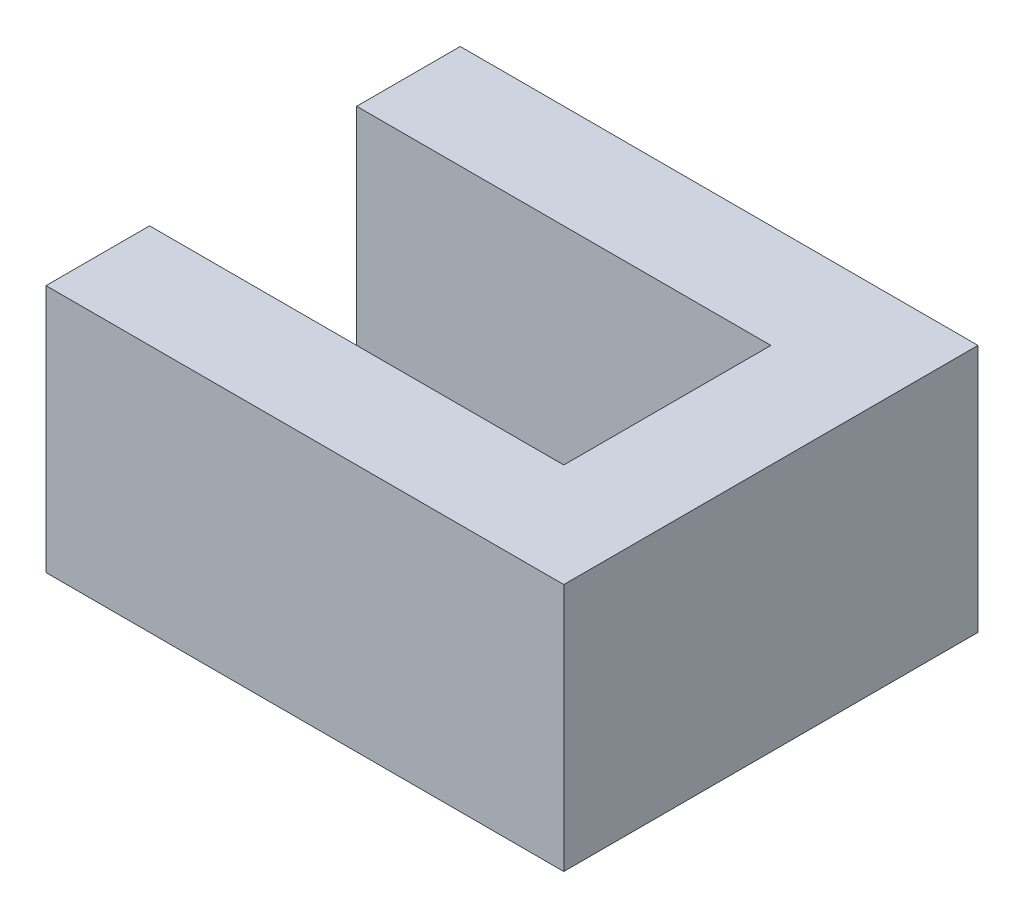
SolidWorks part; units mm, degrees
ref_plane "Plan de face" through (0, 0, 0) normal (0, 0, 1) x (1, 0, 0)
ref_plane "Plan de dessus" through (0, 0, 0) normal (0, 1, 0) x (1, 0, 0)
ref_plane "Plan de droite" through (0, 0, 0) normal (1, 0, 0) x (0, 0, -1)
sketch "Esquisse1" plane through (0, 0, 0) normal (0, 1, 0) x (1, 0, 0)
  line L0 (0, 10) -> (-40, 10)
  line L1 (-40, 10) -> (-40, 20)
  line L2 (-40, 20) -> (10, 20)
  line L3 (10, 20) -> (10, -20)
  line L4 (10, -20) -> (-40, -20)
  line L5 (-40, -20) -> (-40, -10)
  line L6 (-40, -10) -> (0, -10)
  line L7 (0, -10) -> (0, 10)
  dimension "D1" = 10
  dimension "D2" = 20
  dimension "D3" = 50
  dimension "D4" = 40
extrude "Extrusion1" add sketch "Esquisse1" along normal blind 24
